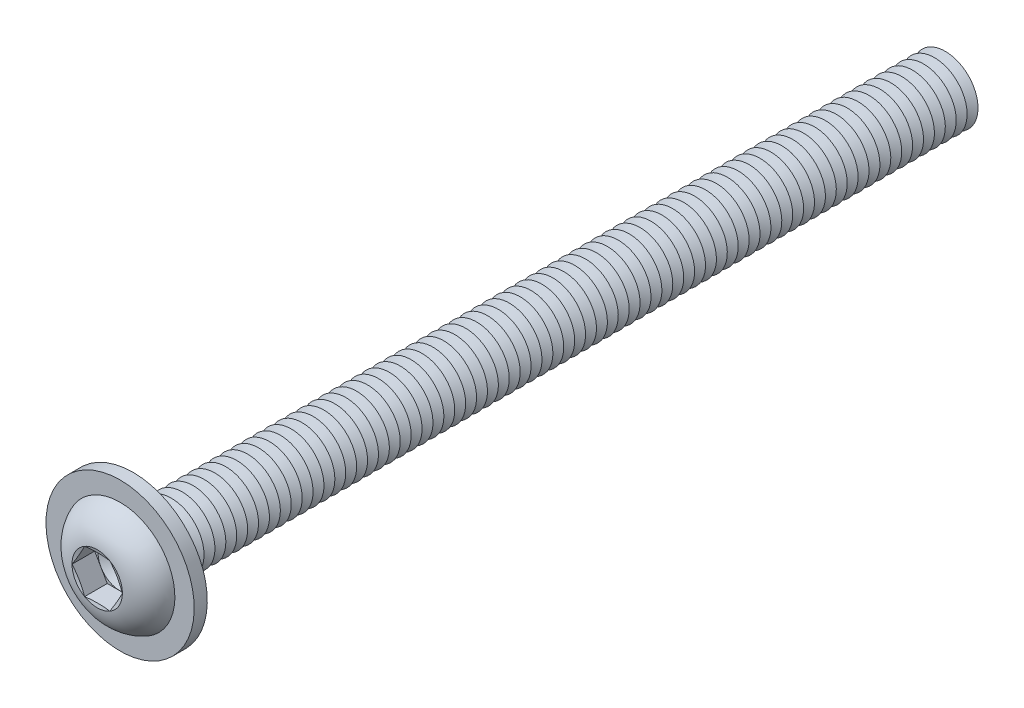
SolidWorks part; units mm, degrees
ref_plane "Front Plane" through (0, 0, 0) normal (0, 0, 1) x (1, 0, 0)
ref_plane "Top Plane" through (0, 0, 0) normal (0, 1, 0) x (1, 0, 0)
ref_plane "Right Plane" through (0, 0, 0) normal (1, 0, 0) x (0, 0, -1)
sketch "Sketch1" plane through (0, 0, 0) normal (1, 0, 0) x (0, 0, -1)
  line L0 (0, 3) -> (0, 5.25)
  line L3 (0, 3) -> (75, 3)
  line L4 (75, 3) -> (75, 0)
  line L5 (75, 0) -> (-3.3, 0) construction
  line L6 (-3.3, 0) -> (75, 0)
  line L7 (-3.3, 2.3094) -> (-3.3, 1.1547) construction
  line L8 (-3.3, 1.1547) -> (-3.3, 0)
  line L9 (-3.3, 2.3094) -> (-2.9906, 1.1547)
  line L10 (-2.9906, 1.1547) -> (-3.3, 1.1547)
  line L11 (75, 0) -> (22.7481, 0) construction
  line L12 (0, 5.25) -> (-3.3, 5.25) construction
  arc A1 (0, 5.25) -> (-3.3, 2.3094) centre (0, 1.928) ccw
  point P8 (75, 1.5)
  dimension "D1" = 10.5
  dimension "D2" = 6
  dimension "D3" = 3.3
  dimension "D4" = 4.6188
  dimension "D5" = 75
  dimension "D6" = 15
revolve "Revolve1" add sketch "Sketch1" angle 360 about L5
fillet "Fillet1" radius 0.5 1 edges at (0, 3, 0)
sketch "Sketch2" plane through (0, 0, 0) normal (1, 0, 0) x (0, 0, -1)
  line L0 (74.5, 3) -> (75.5, 3)
  line L1 (75, 3) -> (0.5, 3) construction
  line L2 (75.5, 3) -> (75, 2.134)
  line L3 (75, -3) -> (75, 3) construction
  line L4 (75, 2.134) -> (74.5, 3)
  dimension "D1" = 1
revolve "Cut-Revolve1" cut sketch "Sketch2" angle 360 about axis through (0, 0, -75) along (0, 0, -1)
pattern_linear "LPattern1" count 75 spacing 1 along (0, 0, 1) of "Cut-Revolve1"
sketch "Sketch3" plane through (0, 0, 3.3) normal (0, 0, 1) x (1, 0, 0)
  line L7 (1.1547, 2) -> (-1.1547, 2)
  line L8 (-1.1547, 2) -> (-2.3094, 0)
  line L9 (-2.3094, 0) -> (-1.1547, -2)
  line L10 (-1.1547, -2) -> (1.1547, -2)
  line L11 (1.1547, -2) -> (2.3094, 0)
  line L12 (2.3094, 0) -> (1.1547, 2)
  circle A0 centre (0, 0) radius 2 construction
  circle A3 centre (0, 0) radius 2.3094 construction
extrude "Cut-Extrude1" cut sketch "Sketch3" against normal blind 2.08
sketch "Sketch4" plane through (0, 0, 1.22) normal (0, 0, 1) x (1, 0, 0)
  line L1 (1.1547, 2) -> (-1.1547, 2) construction
  circle A0 centre (0, 0) radius 2
extrude "Cut-Extrude2" cut sketch "Sketch4" against normal through all draft 60
sketch "Sketch5" plane through (0, 0, 0) normal (0, 0, -1) x (-1, 0, 0)
  circle A0 centre (0, 0) radius 6.8
  circle A1 centre (0, 0) radius 3.5
  circle A2 centre (0, 0) radius 3.5 construction
  dimension "D1" = 13.6
extrude "Boss-Extrude1" add sketch "Sketch5" against normal blind 1.2
